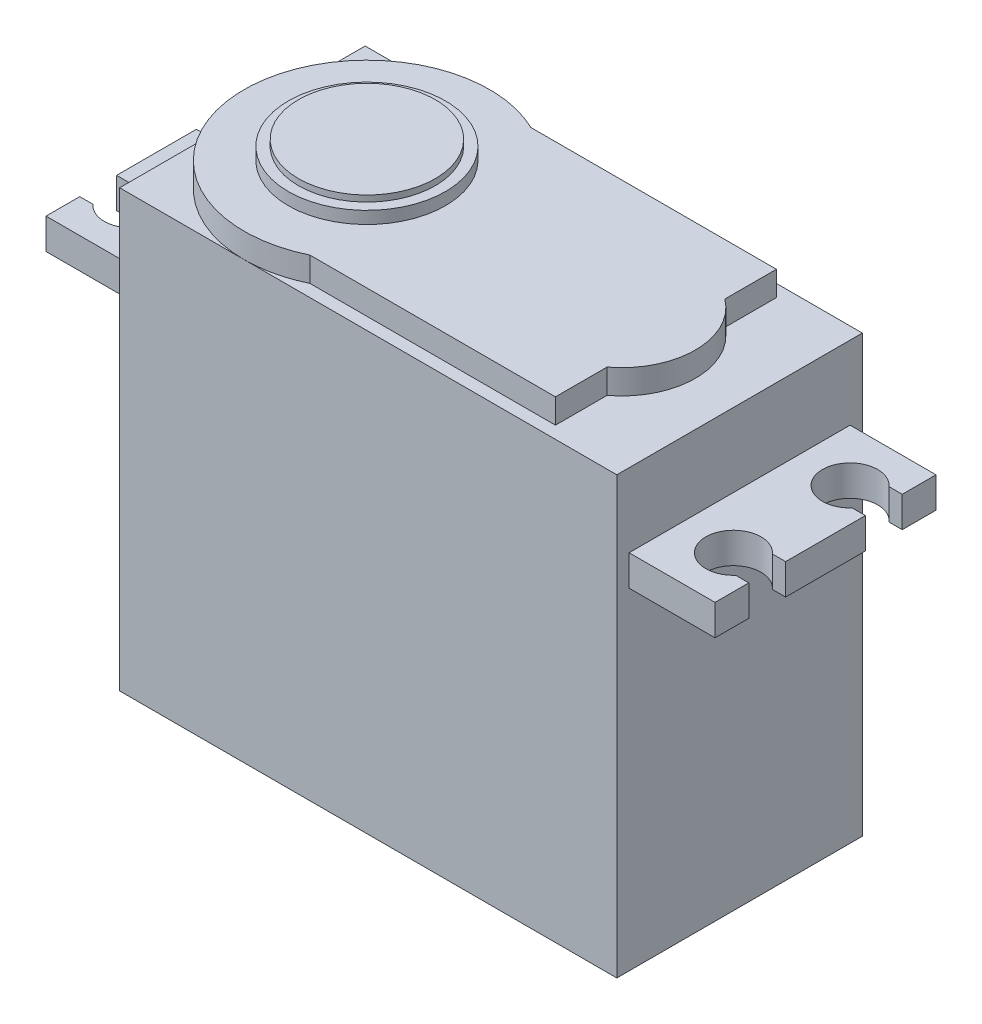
SolidWorks part; units mm, degrees
ref_plane "Front" through (0, 0, 0) normal (0, 0, 1) x (1, 0, 0)
ref_plane "Top" through (0, 0, 0) normal (0, 1, 0) x (1, 0, 0)
ref_plane "Right" through (0, 0, 0) normal (1, 0, 0) x (0, 0, -1)
sketch "Sketch1" plane through (0, 0, 0) normal (0, 1, 0) x (1, 0, 0)
  line L0 (-20.25, 10) -> (20.25, -10) construction
  line L1 (-20.25, -10) -> (20.25, -10)
  line L2 (-20.25, -10) -> (-20.25, 10)
  line L3 (-20.25, 10) -> (20.25, 10)
  line L4 (20.25, -10) -> (20.25, 10)
  line L5 (20.25, 10) -> (-20.25, -10) construction
  dimension "D1" = 20
  dimension "D2" = 40.5
extrude "Boss-Extrude1" add sketch "Sketch1" along normal blind 35.5
sketch "Sketch2" plane through (0, 35.5, 0) normal (0, 1, 0) x (1, 0, 0)
  line L0 (-5.75, -9) -> (14.25, -9)
  line L1 (14.25, -9) -> (14.25, -4.8)
  line L2 (-5.75, 9) -> (14.25, 9)
  line L3 (14.25, 9) -> (14.25, 4.8)
  line L4 (20.25, 10) -> (-20.25, 10) construction
  line L5 (-20.25, -10) -> (20.25, -10) construction
  line L6 (20.25, -10) -> (20.25, 10) construction
  line L7 (20.25, -10) -> (20.25, 10) construction
  arc A0 (-5.75, 9) -> (-5.75, -9) centre (-10.1089, 0) ccw
  arc A1 (14.25, 4.8) -> (14.25, -4.8) centre (10.65, 0) cw
  point P6 (0, 10)
  point P12 (16.65, 0)
  point P13 (20.25, 0)
  dimension "D1" = 1
  dimension "D3" = 4.2
  dimension "D2" = 1
  dimension "D4" = 3.6
  dimension "D5" = 20
  dimension "D6" = 6
extrude "Boss-Extrude2" add sketch "Sketch2" along normal blind 2
sketch "Sketch3" plane through (0, 37.5, 0) normal (0, 1, 0) x (1, 0, 0)
  circle A0 centre (-10.1089, 0) radius 6.4
  arc A1 (-10.1089, 10) -> (-10.1089, -10) centre (-10.1089, 0) ccw construction
  dimension "D1" = 12.8
extrude "Boss-Extrude3" add sketch "Sketch3" along normal blind 1
sketch "Sketch4" plane through (0, 38.5, 0) normal (0, 1, 0) x (1, 0, 0)
  circle A0 centre (-10.1089, 0) radius 5.575
  circle A1 centre (-10.1089, 0) radius 6.4 construction
  dimension "D1" = 11.15
extrude "Boss-Extrude4" add sketch "Sketch4" along normal blind 0.5
ref_plane "Plane1" through (0, 29.5, 0) normal (0, 1, 0) x (1, 0, 0)
sketch "Sketch5" plane through (0, 29.5, 0) normal (0, 1, 0) x (1, 0, 0)
  line L0 (20.25, 9) -> (27.25, 9)
  line L1 (20.25, -10) -> (20.25, 10) construction
  line L2 (27.25, 0) -> (27.25, 3.25)
  line L3 (20.25, 0) -> (27.25, 0)
  line L4 (20.25, 0) -> (20.25, 9)
  line L5 (20.25, 10) -> (-10.1089, 10) construction
  line L7 (24.5, 7) -> (24.5, 9) construction
  line L8 (27.25, 6.25) -> (27.25, 9)
  line L9 (26.1771, 6.25) -> (27.25, 6.25)
  line L10 (26.1771, 3.25) -> (27.25, 3.25)
  arc A0 (26.1771, 6.25) -> (26.1771, 3.25) centre (24.5, 4.75) ccw
  point P9 (22.25, 4.75)
  dimension "D4" = 4.5
  dimension "D5" = 2
  dimension "D1" = 1
  dimension "D2" = 9
  dimension "D3" = 7
  dimension "D6" = 3
  dimension "D7" = 2
extrude "Boss-Extrude5" add sketch "Sketch5" against normal blind 2.5
mirror "Mirror1" about plane through (0, 0, 0) normal (1, 0, 0) of "Boss-Extrude5"
mirror "Mirror2" about plane through (0, 0, 0) normal (0, 0, 1) of "Boss-Extrude5", "Mirror1"
